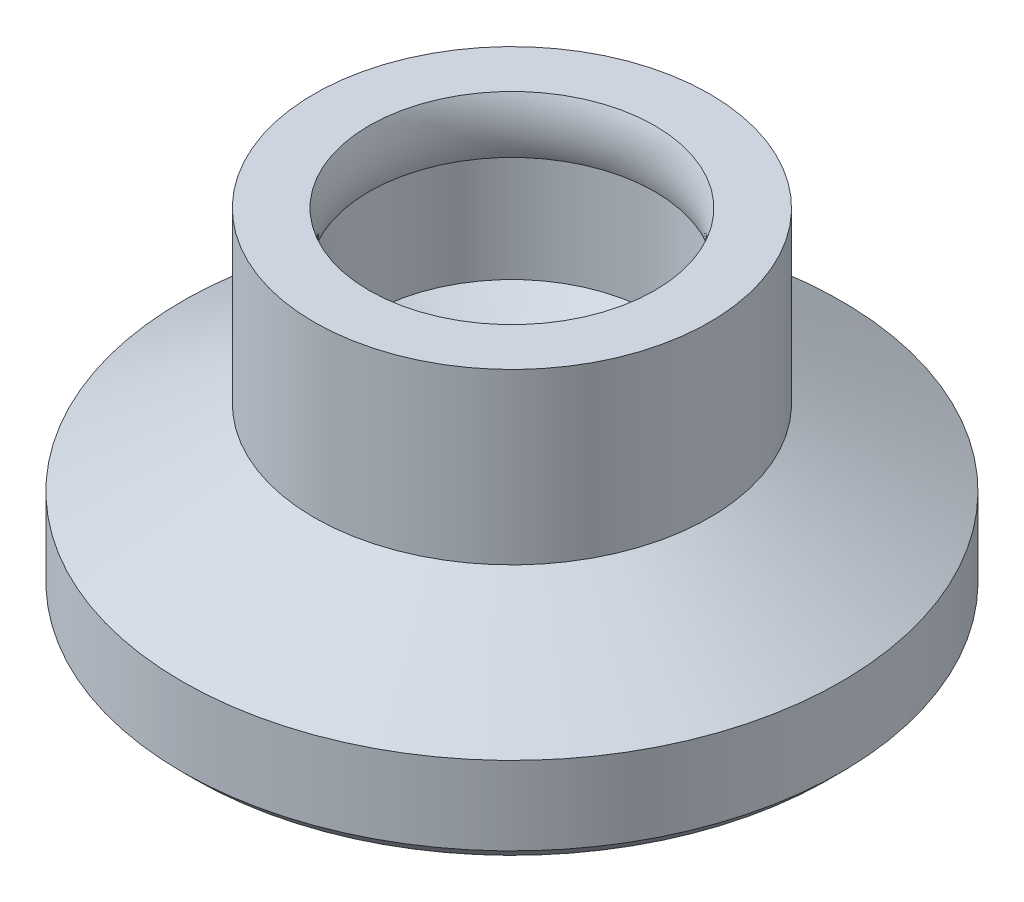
SolidWorks part; units mm, degrees
ref_plane "Front Plane" through (0, 0, 0) normal (0, 0, 1) x (1, 0, 0)
ref_plane "Top Plane" through (0, 0, 0) normal (0, 1, 0) x (1, 0, 0)
ref_plane "Right Plane" through (0, 0, 0) normal (1, 0, 0) x (0, 0, -1)
sketch "Sketch1" plane through (0, 0, 0) normal (0, 1, 0) x (1, 0, 0)
  circle A0 centre (0, 0) radius 5.4
  dimension "D1" = 10.8
extrude "Extrude1" add sketch "Sketch1" along normal mid plane 9.2
sketch "Sketch3" plane through (0, -4.6, 0) normal (0, -1, 0) x (1, 0, 0)
  circle A0 centre (0, 0) radius 9
  dimension "D1" = 18
extrude "Extrude2" add sketch "Sketch3" against normal blind 2.5
sketch "Sketch4" plane through (0, 0, 0) normal (0, 0, 1) x (1, 0, 0)
  line L0 (-9, -2.1) -> (-5.4, -0.0215)
  line L1 (-5.4, 4.6) -> (-5.4, -2.1) construction
  line L2 (-5.4, -0.0215) -> (-5.4, -2.1)
  line L3 (-5.4, -2.1) -> (-9, -2.1)
  dimension "D1" = 30
revolve "Revolve1" add sketch "Sketch4" angle 360 about axis through (0, 4.6, 0) along (0, -1, 0)
chamfer "Chamfer1" distance 0.36 angle 45 1 edges at (0, -4.6, -9)
sketch "Sketch5" plane through (0, 0, 0) normal (0, 0, 1) x (1, 0, 0)
  line L1 (0, 0) -> (0, 11.3083) construction
  line L2 (0, 4.6) -> (3.9, 4.6)
  line L3 (5.4, 4.6) -> (-5.4, 4.6) construction
  line L4 (3.9, 3.04) -> (3.9, 0.1517)
  line L5 (3.9, 0.1517) -> (0, -2.1)
  line L6 (0, -2.1) -> (0, 4.6)
  line L7 (9, -2.1) -> (-9, -2.1) construction
  arc A0 (3.9, 4.6) -> (3.9, 3.04) centre (5.772, 3.82) ccw
  point P14 (3.744, 3.82)
  dimension "D2" = 7.8
  dimension "D1" = 60
  dimension "D3" = 1.56
  dimension "D4" = 0.156
revolve "Cut-Revolve1" cut sketch "Sketch5" angle 360 about L1
equation "\"D3@Sketch5\" = \"D2@Sketch5\"*0.2"
equation "\"D4@Sketch5\" = \"D3@Sketch5\"*0.1"
